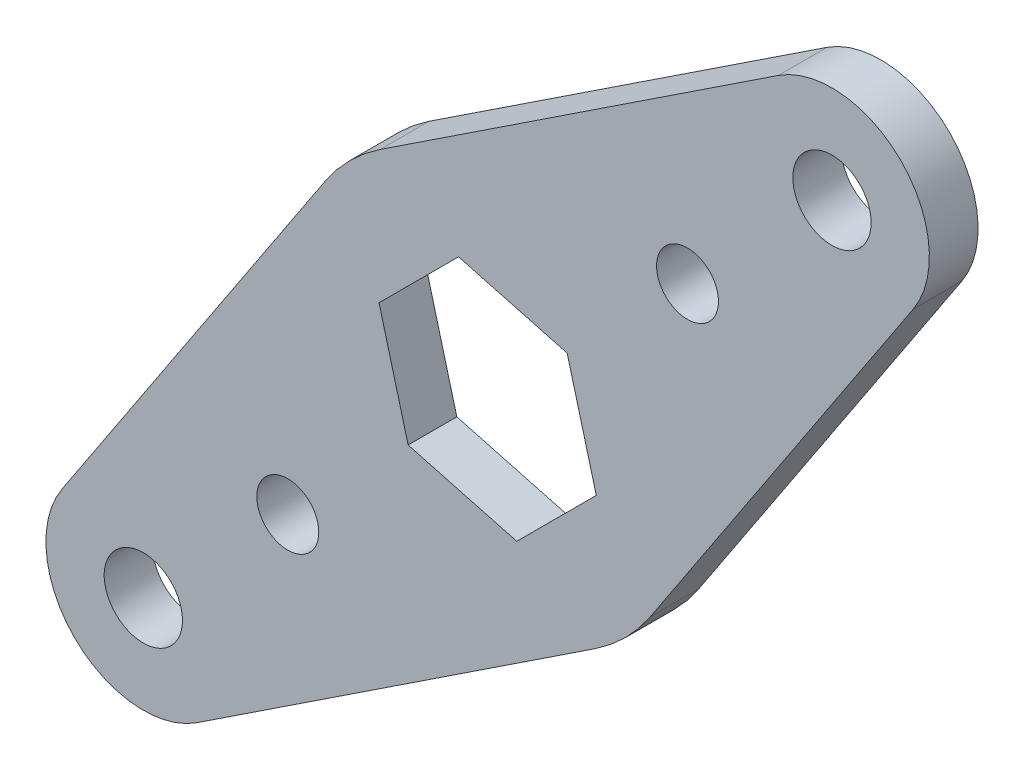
SolidWorks part; units mm, degrees
ref_plane "Front Plane" through (0, 0, 0) normal (0, 0, 1) x (1, 0, 0)
ref_plane "Top Plane" through (0, 0, 0) normal (0, 1, 0) x (1, 0, 0)
ref_plane "Right Plane" through (0, 0, 0) normal (1, 0, 0) x (0, 0, -1)
sketch "Sketch1" plane through (0, 0, 0) normal (0, 0, 1) x (1, 0, 0)
  line L0 (22.4506, 22.4506) -> (-22.4506, -22.4506) construction
  line L1 (0, 0) -> (14.2875, 0) construction
  line L2 (13.0304, 13.0304) -> (-13.0304, -13.0304) construction
  line L3 (-7.0028, 10.5949) -> (18.9493, 27.7481)
  line L4 (27.7481, 18.9493) -> (10.5949, -7.0028)
  line L5 (-18.9493, -27.7481) -> (7.0028, -10.5949)
  line L6 (-10.5949, 7.0028) -> (-27.7481, -18.9493)
  line L8 (-5.1848, -5.1848) -> (1.8978, -7.0825)
  line L9 (1.8978, -7.0825) -> (7.0825, -1.8978)
  line L10 (7.0825, -1.8978) -> (5.1848, 5.1848)
  line L11 (5.1848, 5.1848) -> (-1.8978, 7.0825)
  line L12 (-1.8978, 7.0825) -> (-7.0825, 1.8978)
  line L13 (-7.0825, 1.8978) -> (-5.1848, -5.1848)
  circle A0 centre (0, 0) radius 6.35 construction
  circle A1 centre (0, 0) radius 15.875 construction
  circle A2 centre (22.4506, 22.4506) radius 2.5527
  circle A3 centre (-22.4506, -22.4506) radius 2.5527
  circle A4 centre (-13.0304, -13.0304) radius 2.0193
  circle A5 centre (13.0304, 13.0304) radius 2.0193
  circle A6 centre (13.0304, 13.0304) radius 2.5527 construction
  arc A7 (27.7481, 18.9493) -> (18.9493, 27.7481) centre (22.4506, 22.4506) ccw
  arc A8 (-27.7481, -18.9493) -> (-18.9493, -27.7481) centre (-22.4506, -22.4506) ccw
  arc A9 (-7.0028, 10.5949) -> (-10.5949, 7.0028) centre (0, 0) ccw
  arc A10 (7.0028, -10.5949) -> (10.5949, -7.0028) centre (0, 0) ccw
  dimension "D3" = 5.1054
  dimension "D6" = 4.0386
  dimension "D7" = 5.1054
  dimension "D9" = 12.7
  dimension "D10" = 25.4
  dimension "D2" = 12.7
  dimension "D11" = 31.75
  dimension "D4" = 45
  dimension "D5" = 31.75
  dimension "D8" = 135
  dimension "D12" = 18.4277
extrude "Boss-Extrude1" add sketch "Sketch1" along normal blind 3.175
ref_plane "Plane1" through (-1.805, 1.805, 0) normal (0.7071, -0.7071, 0) x (-0.7071, -0.7071, 0)
